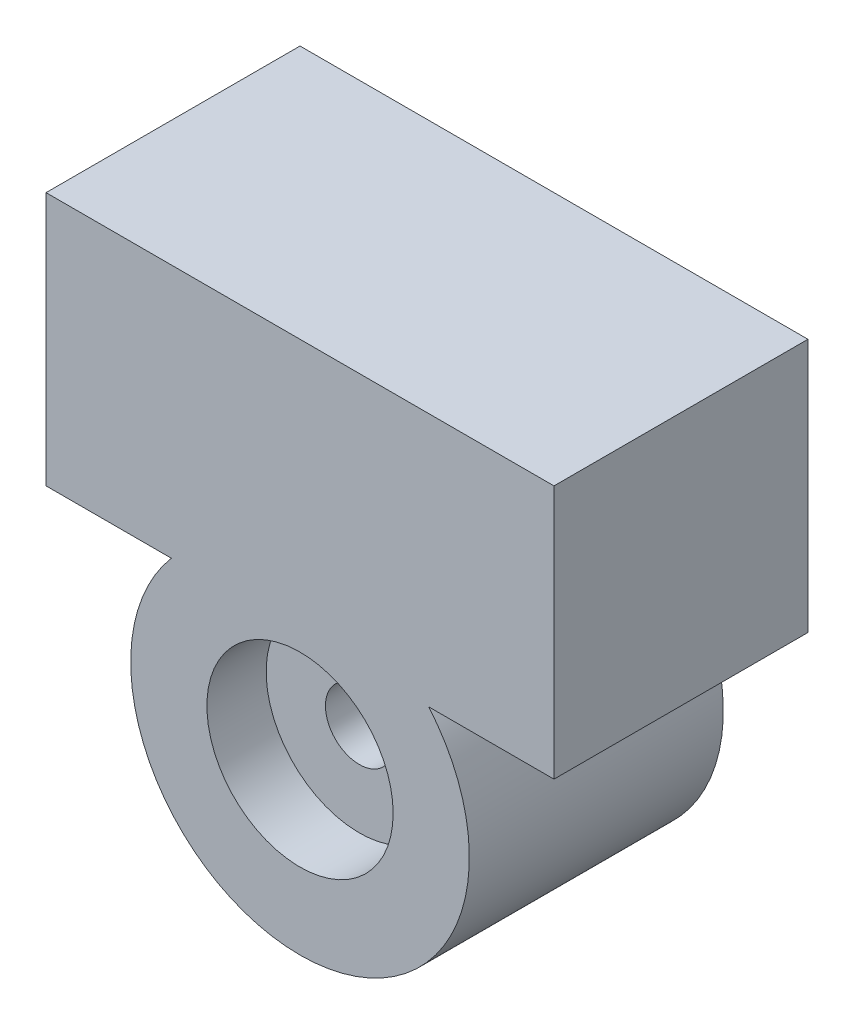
SolidWorks part; units mm, degrees
ref_plane "Alzado" through (0, 0, 0) normal (0, 0, 1) x (1, 0, 0)
ref_plane "Planta" through (0, 0, 0) normal (0, 1, 0) x (1, 0, 0)
ref_plane "Vista lateral" through (0, 0, 0) normal (1, 0, 0) x (0, 0, -1)
sketch "Croquis1" plane through (0, 0, 0) normal (0, 0, 1) x (1, 0, 0)
  line L0 (-15.1987, 13) -> (-30.0013, 13)
  line L1 (-30.0013, 13) -> (-30.0013, 43)
  line L2 (-30.0013, 43) -> (29.9987, 43)
  line L3 (29.9987, 43) -> (29.9987, 13)
  line L4 (29.9987, 13) -> (15.1987, 13)
  arc A0 (-15.1987, 13) -> (15.1987, 13) centre (0, 0) ccw
  dimension "D1" = 40
  dimension "D2" = 60
  dimension "D3" = 13
  dimension "D4" = 13
  dimension "D6" = 30
  dimension "D7" = 14.8
extrude "Saliente-Extruir1" add sketch "Croquis1" along normal blind 30
sketch "Croquis2" plane through (0, 0, 30) normal (0, 0, 1) x (1, 0, 0)
  circle A0 centre (0, 0) radius 11
  dimension "D1" = 22
extrude "Cortar-Extruir1" cut sketch "Croquis2" against normal blind 7
sketch "Croquis3" plane through (0, 0, 23) normal (0, 0, 1) x (1, 0, 0)
  circle A0 centre (0, 0) radius 4
  dimension "D1" = 8
extrude "Cortar-Extruir2" cut sketch "Croquis3" against normal through all both and the other way through all
